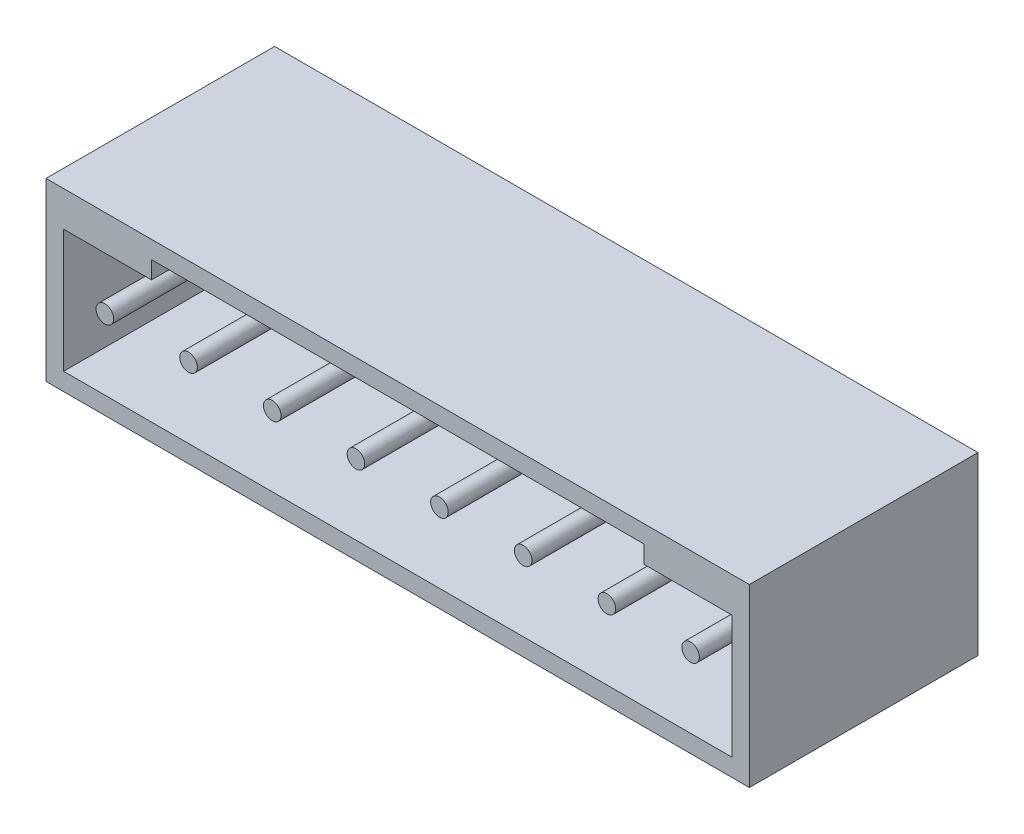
SolidWorks part; units mm, degrees
ref_plane "前视基准面" through (0, 0, 0) normal (0, 0, 1) x (1, 0, 0)
ref_plane "上视基准面" through (0, 0, 0) normal (0, 1, 0) x (1, 0, 0)
ref_plane "右视基准面" through (0, 0, 0) normal (1, 0, 0) x (0, 0, -1)
sketch "草图1" plane through (0, 0, 0) normal (0, 0, 1) x (1, 0, 0)
  line L0 (0, -0.9035) -> (0, 5.8733) construction
  line L1 (-10, 2.5) -> (10, 2.5)
  line L2 (-10, 2.5) -> (-10, -2.5)
  line L3 (-10, -2.5) -> (10, -2.5)
  line L4 (10, 2.5) -> (10, -2.5)
  line L5 (-10, 2.5) -> (10, -2.5) construction
  line L6 (-10, -2.5) -> (10, 2.5) construction
  line L7 (-9.5, -2) -> (-9.5, 1.5)
  line L8 (-9.5, 1.5) -> (-7, 1.5)
  line L9 (-7, 1.5) -> (-7, 2)
  line L10 (-7, 2) -> (7, 2)
  line L11 (-9.5, -2) -> (9.5, -2)
  line L12 (7, 1.5) -> (7, 2)
  line L13 (9.5, 1.5) -> (7, 1.5)
  line L14 (9.5, -2) -> (9.5, 1.5)
  line L15 (-11.1036, 0) -> (10.8974, 0) construction
  point P0 (0, 0)
  point P15 (0, 2)
  point P18 (0, -2)
  dimension "D1" = 20
  dimension "D2" = 5
  dimension "D3" = 0.5
  dimension "D4" = 0.5
  dimension "D5" = 1
  dimension "D6" = 3
  dimension "D7" = 0.5
extrude "凸台-拉伸1" add sketch "草图1" along normal blind 6
sketch "草图2" plane through (0, 0, 0) normal (0, 0, -1) x (-1, 0, 0)
  line L1 (-10, 2.5) -> (10, 2.5)
  line L2 (-10, 2.5) -> (-10, -2.5)
  line L3 (-10, -2.5) -> (10, -2.5)
  line L4 (10, 2.5) -> (10, -2.5)
extrude "凸台-拉伸2" add sketch "草图2" along normal blind 0.5
sketch "草图3" plane through (0, 0, 0) normal (0, 0, 1) x (1, 0, 0)
  line L0 (-15.519, 0) -> (14.3821, 0) construction
  line L1 (0, 8.2569) -> (0, -7.9443) construction
  circle A0 centre (-1.1875, 0) radius 0.25
  circle A1 centre (-3.5675, 0) radius 0.25
  circle A2 centre (-5.9475, 0) radius 0.25
  circle A3 centre (-8.3275, 0) radius 0.25
  circle A4 centre (1.1875, 0) radius 0.25
  circle A5 centre (3.5675, 0) radius 0.25
  circle A6 centre (5.9475, 0) radius 0.25
  circle A7 centre (8.3275, 0) radius 0.25
  dimension "D1" = 0.5
  dimension "D2" = 1.1875
  dimension "D3" = 4
extrude "凸台-拉伸3" add sketch "草图3" along normal up to vertex (6 mm away)
